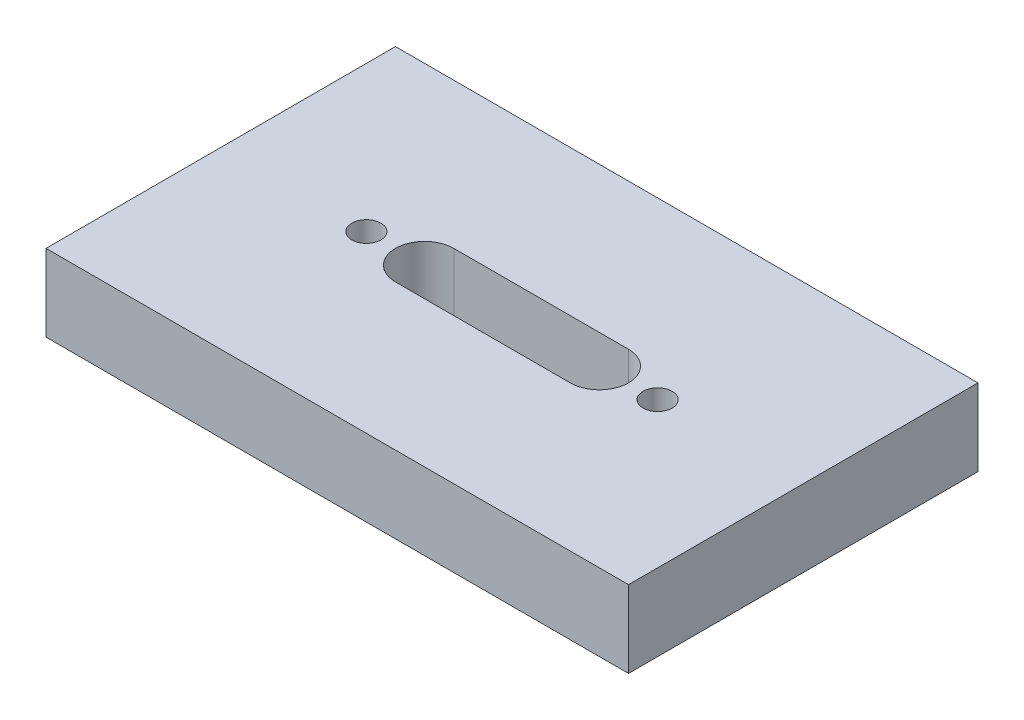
SolidWorks part; units mm, degrees
ref_plane "Front Plane" through (0, 0, 0) normal (0, 0, 1) x (1, 0, 0)
ref_plane "Top Plane" through (0, 0, 0) normal (0, 1, 0) x (1, 0, 0)
ref_plane "Right Plane" through (0, 0, 0) normal (1, 0, 0) x (0, 0, -1)
sketch "Sketch1" plane through (0, 0, 0) normal (0, 1, 0) x (1, 0, 0)
  line L1 (-63.5, -38.1) -> (63.5, -38.1)
  line L2 (-63.5, -38.1) -> (-63.5, 38.1)
  line L3 (-63.5, 38.1) -> (63.5, 38.1)
  line L4 (63.5, -38.1) -> (63.5, 38.1)
  line L5 (-63.5, -38.1) -> (63.5, 38.1) construction
  line L6 (-63.5, 38.1) -> (63.5, -38.1) construction
  point P0 (0, 0)
  dimension "D1" = 76.2
  dimension "D2" = 127
extrude "Boss-Extrude1" add sketch "Sketch1" along normal blind 16.764
sketch "Sketch2" plane through (0, 16.764, 0) normal (0, 1, 0) x (1, 0, 0)
  line L0 (-19.05, 0) -> (19.05, 0) construction
  line L1 (-19.05, 6.35) -> (19.05, 6.35)
  line L2 (-19.05, -6.35) -> (19.05, -6.35)
  line L3 (0, 0) -> (0, 11.7184) construction
  arc A0 (-19.05, 6.35) -> (-19.05, -6.35) centre (-19.05, 0) ccw
  arc A1 (19.05, -6.35) -> (19.05, 6.35) centre (19.05, 0) ccw
  circle A2 centre (31.75, 0) radius 3.175
  circle A3 centre (-31.75, 0) radius 3.175
  point P3 (0, 0)
  dimension "D1" = 6.35
  dimension "D3" = 6.35
  dimension "D2" = 38.1
  dimension "D4" = 12.7
extrude "Cut-Extrude1" cut sketch "Sketch2" against normal through all
